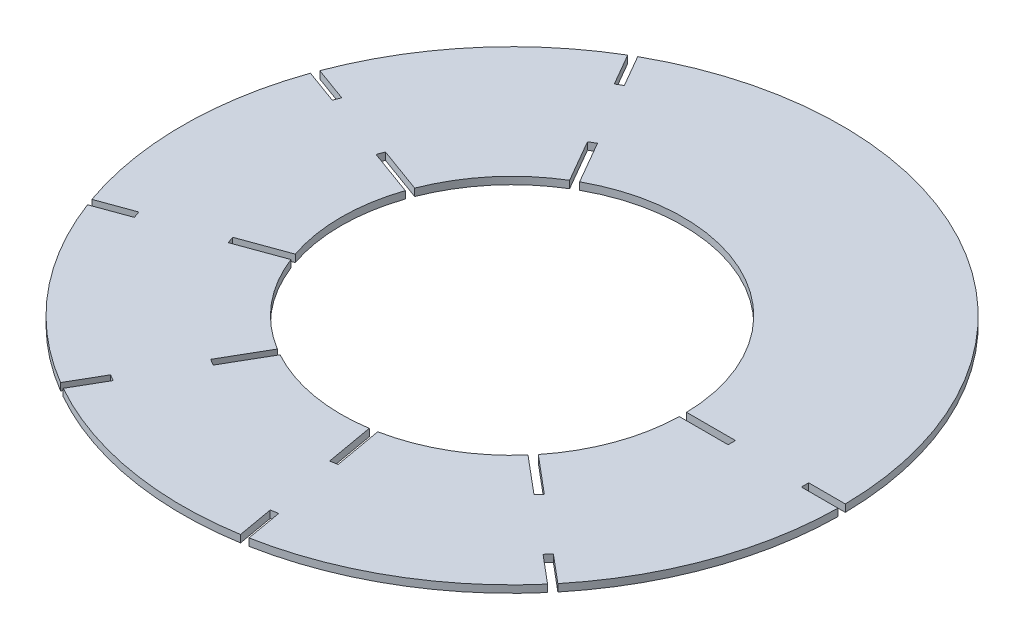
SolidWorks part; units mm, degrees
ref_plane "Front Plane" through (0, 0, 0) normal (0, 0, 1) x (1, 0, 0)
ref_plane "Top Plane" through (0, 0, 0) normal (0, 1, 0) x (1, 0, 0)
ref_plane "Right Plane" through (0, 0, 0) normal (1, 0, 0) x (0, 0, -1)
sketch "Sketch1" plane through (0, 0, 0) normal (0, 1, 0) x (1, 0, 0)
  circle A0 centre (0, 0) radius 675
  circle A1 centre (0, 0) radius 350
extrude "Boss-Extrude1" add sketch "Sketch1" along normal blind 15 contours A0
sketch "Sketch2" plane through (0, 15, 0) normal (0, 1, 0) x (1, 0, 0)
  line L0 (0, 0) -> (675, 0) construction
  line L1 (600, 7.5) -> (700, 7.5)
  line L2 (345, 7.5) -> (450, 7.5)
  line L3 (345, 7.5) -> (345, -7.5)
  line L4 (345, -7.5) -> (450, -7.5)
  line L5 (450, 7.5) -> (450, -7.5)
  line L6 (600, 7.5) -> (600, -7.5)
  line L7 (600, -7.5) -> (700, -7.5)
  line L8 (111.575, -589.5823) -> (128.9398, -688.0631)
  line L9 (67.2947, -338.4563) -> (85.5277, -441.8611)
  line L10 (67.2947, -338.4563) -> (52.5226, -341.061)
  line L11 (52.5226, -341.061) -> (70.7556, -444.4659)
  line L12 (85.5277, -441.8611) -> (70.7556, -444.4659)
  line L13 (111.575, -589.5823) -> (96.8028, -592.187)
  line L14 (96.8028, -592.187) -> (114.1677, -690.6678)
  line L15 (464.4476, -379.9272) -> (541.052, -444.206)
  line L16 (269.1062, -216.0164) -> (349.5409, -283.5091)
  line L17 (269.1062, -216.0164) -> (259.4644, -227.5071)
  line L18 (259.4644, -227.5071) -> (339.8991, -294.9998)
  line L19 (349.5409, -283.5091) -> (339.8991, -294.9998)
  line L20 (464.4476, -379.9272) -> (454.8058, -391.4179)
  line L21 (454.8058, -391.4179) -> (531.4102, -455.6967)
  line L22 (0, 0) -> (117.2125, -664.7452) construction
  line L23 (-293.5048, -523.3652) -> (-343.5048, -609.9678)
  line L24 (-166.0048, -302.5288) -> (-218.5048, -393.4614)
  line L25 (-166.0048, -302.5288) -> (-178.9952, -295.0288)
  line L26 (-178.9952, -295.0288) -> (-231.4952, -385.9614)
  line L27 (-218.5048, -393.4614) -> (-231.4952, -385.9614)
  line L28 (-293.5048, -523.3652) -> (-306.4952, -515.8652)
  line L29 (0, 0) -> (517.08, -433.8816) construction
  line L30 (-306.4952, -515.8652) -> (-356.4952, -602.4678)
  line L31 (0, 0) -> (-337.5, -584.5671) construction
  line L32 (-561.2504, -212.2598) -> (-655.2197, -246.4618)
  line L33 (-321.6288, -125.0446) -> (-420.2965, -160.9568)
  line L34 (-321.6288, -125.0446) -> (-326.7591, -110.9493)
  line L35 (-326.7591, -110.9493) -> (-425.4268, -146.8614)
  line L36 (-420.2965, -160.9568) -> (-425.4268, -146.8614)
  line L37 (-561.2504, -212.2598) -> (-566.3807, -198.1644)
  line L38 (-566.3807, -198.1644) -> (-660.35, -232.3664)
  line L39 (0, 0) -> (-634.2925, -230.8636) construction
  line L40 (-566.3807, 198.1644) -> (-660.35, 232.3664)
  line L41 (-326.7591, 110.9493) -> (-425.4268, 146.8614)
  line L42 (-326.7591, 110.9493) -> (-321.6288, 125.0446)
  line L43 (-321.6288, 125.0446) -> (-420.2965, 160.9568)
  line L44 (-425.4268, 146.8614) -> (-420.2965, 160.9568)
  line L45 (-566.3807, 198.1644) -> (-561.2504, 212.2598)
  line L46 (-561.2504, 212.2598) -> (-655.2197, 246.4618)
  line L47 (0, 0) -> (-634.2925, 230.8636) construction
  line L48 (700, 7.5) -> (700, -7.5)
  line L49 (541.052, -444.206) -> (531.4102, -455.6967)
  line L50 (128.9398, -688.0631) -> (114.1677, -690.6678)
  line L51 (-343.5048, -609.9678) -> (-356.4952, -602.4678)
  line L52 (-655.2197, -246.4618) -> (-660.35, -232.3664)
  line L53 (-660.35, 232.3664) -> (-655.2197, 246.4618)
  line L54 (-306.4952, 515.8652) -> (-356.4952, 602.4678)
  line L55 (-178.9952, 295.0288) -> (-231.4952, 385.9614)
  line L56 (-178.9952, 295.0288) -> (-166.0048, 302.5288)
  line L57 (-166.0048, 302.5288) -> (-218.5048, 393.4614)
  line L58 (-231.4952, 385.9614) -> (-218.5048, 393.4614)
  line L59 (-306.4952, 515.8652) -> (-293.5048, 523.3652)
  line L60 (-293.5048, 523.3652) -> (-343.5048, 609.9678)
  line L61 (0, 0) -> (-337.5, 584.5671) construction
  line L62 (-356.4952, 602.4678) -> (-343.5048, 609.9678)
  circle A0 centre (0, 0) radius 675 construction
  point P23 (0, 0)
extrude "Cut-Extrude3" cut sketch "Sketch2" against normal blind 15 contours L35 L36 L33 L34 | L24 L27 L26 L25 | L9 L12 L11 L10 | L16 L19 L18 L17 | L2 L5 L4 L3 | L41 L44 L43 L42 | L1 L48 L7 L6 | L21 L49 L15 L20 | L14 L50 L8 L13 | L30 L51 L23 L28 | L38 L52 L32 L37 | L46 L53 L40 L45 | L57 L58 L55 L56 | L60 L62 L54 L59
equation "\"Inner Circle\"= 350mm"
equation "\"D2@Sketch1\"= \"Inner Circle\""
equation "\"D4@Sketch2\" = \"Inner Circle\" - \"CutExtrude Clearing\""
equation "\"D1@Sketch2\"= 100 + \"CutExtrude Clearing\""
equation "\"CutExtrude Clearing\"= 5mm"
